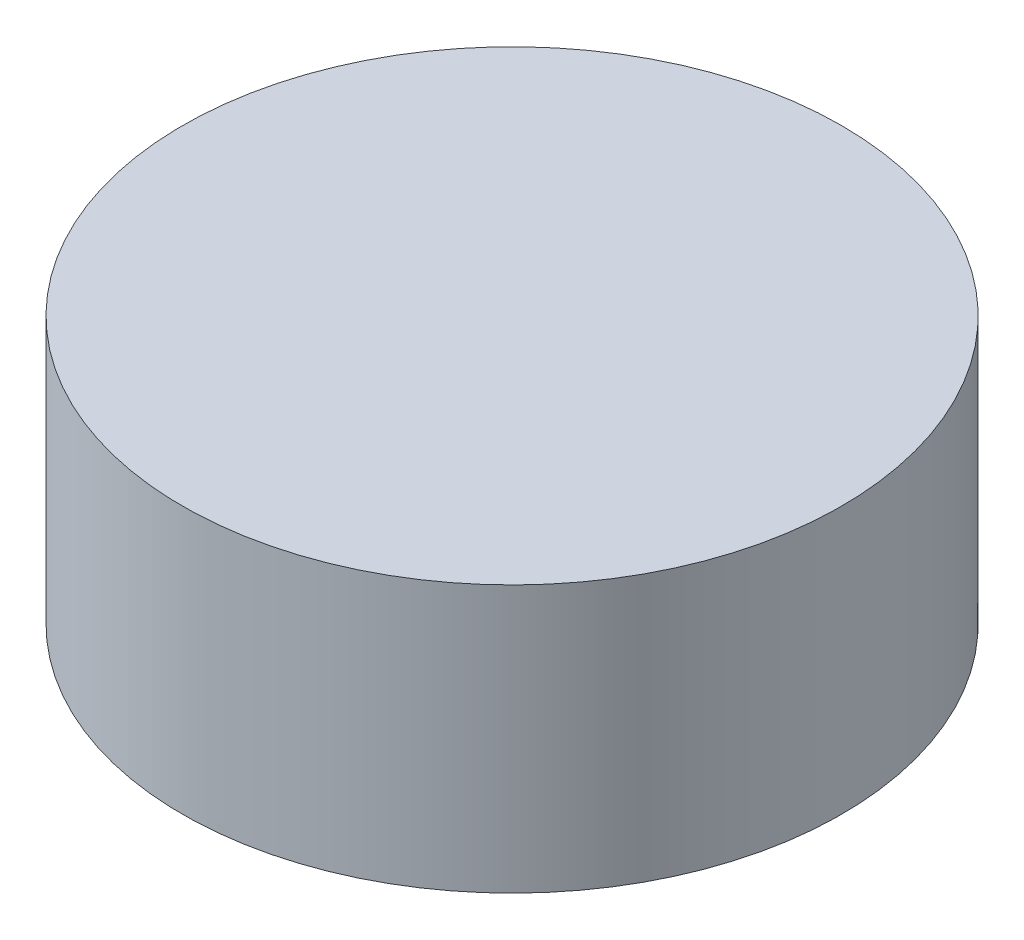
SolidWorks part; units mm, degrees
ref_plane "Ebene vorne" through (0, 0, 0) normal (0, 0, 1) x (1, 0, 0)
ref_plane "Ebene oben" through (0, 0, 0) normal (0, 1, 0) x (1, 0, 0)
ref_plane "Ebene rechts" through (0, 0, 0) normal (1, 0, 0) x (0, 0, -1)
sketch "Skizze1" plane through (0, 0, 0) normal (0, 0, 1) x (1, 0, 0)
  line L0 (57.15, 0) -> (0, 0) construction
  line L1 (0, 0) -> (0, 36.9549) construction
  line L2 (7, 0.1422) -> (7, 5.8115)
  line L3 (7, 5.8115) -> (0, 5.8115)
  line L4 (0, 0) -> (0, -5.0832) construction
  line L5 (0, 5.8115) -> (0, -1.1885)
  arc A0 (5.3197, 0) -> (1.0639, -0.9508) centre (5.3197, -10) ccw
  arc A1 (0, -1.1885) -> (1.0639, -0.9508) centre (0, 1.3115) ccw
  arc A3 (5.3197, 0) -> (7, 0.1422) centre (5.3197, 10) ccw
  dimension "D1" = 20
  dimension "D2" = 5
  dimension "D3" = 1.1885
  dimension "D4" = 7
  dimension "D5" = 7
revolve "Rotation1" add sketch "Skizze1" angle 360 about L1
equation "\"LÄNGE\"=0"
equation "\"BREITE\"=0"
equation "\"HÖHE\"=0"
equation "\"DURCHMESSER\"=0"
equation "\"Stückzahl\"= 1"
